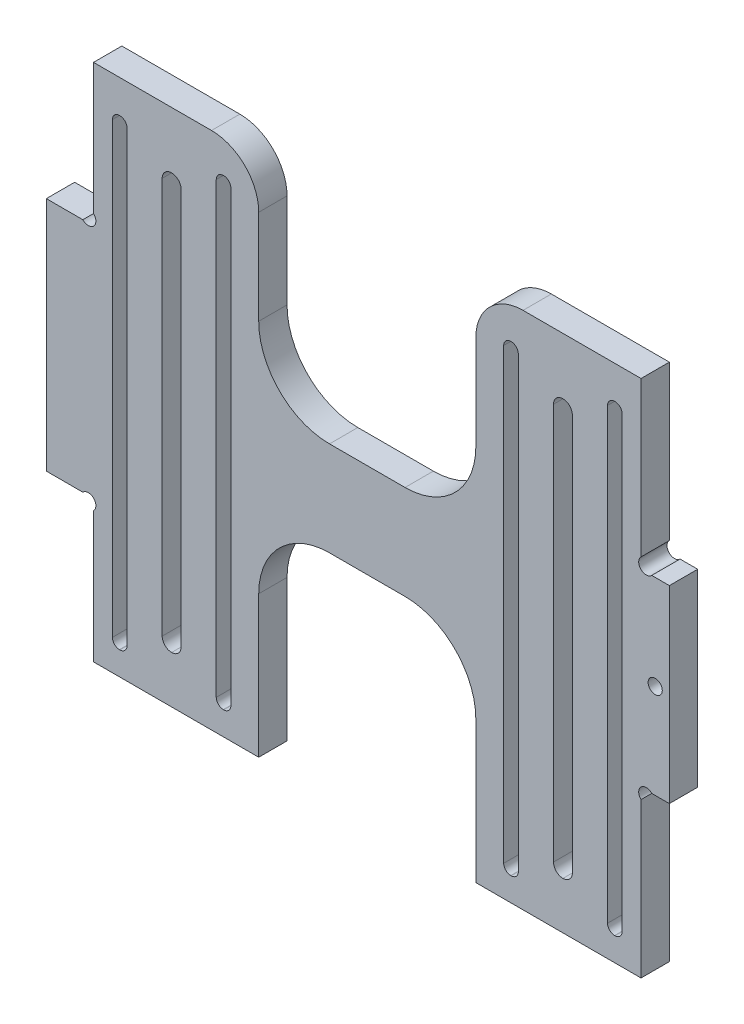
SolidWorks part; units mm, degrees
ref_plane "Face" through (0, 0, 0) normal (0, 0, 1) x (1, 0, 0)
ref_plane "Dessus" through (0, 0, 0) normal (0, 1, 0) x (1, 0, 0)
ref_plane "Droite" through (0, 0, 0) normal (1, 0, 0) x (0, 0, -1)
sketch "Esquisse1" plane through (0, 0, 0) normal (0, 0, 1) x (1, 0, 0)
  line L0 (-35.2138, -44.1969) -> (-35.2138, 65.8031)
  line L1 (-35.2138, 65.8031) -> (-0.2138, 65.8031)
  line L2 (80.7862, 65.8031) -> (80.7862, -44.1969)
  line L3 (80.7862, -44.1969) -> (45.7862, -44.1969)
  line L4 (45.7862, -44.1969) -> (45.7862, 0.8031)
  line L5 (45.7862, 0.8031) -> (-0.2138, 0.8031)
  line L6 (-0.2138, 0.8031) -> (-0.2138, -44.1969)
  line L7 (-0.2138, -44.1969) -> (-35.2138, -44.1969)
  line L8 (45.7862, 65.8031) -> (80.7862, 65.8031)
  line L10 (-0.2138, 65.8031) -> (-0.2138, 20.8031)
  line L11 (-0.2138, 20.8031) -> (45.7862, 20.8031)
  line L12 (45.7862, 65.8031) -> (45.7862, 20.8031)
  dimension "D1" = 116
  dimension "D2" = 110
  dimension "D3" = 35
  dimension "D4" = 35
  dimension "D5" = 110
  dimension "D6" = 45
  dimension "D7" = 45
extrude "Extrusion1" add sketch "Esquisse1" along normal blind 6
fillet "Congé1" radius 15 4 edges at (45.7862, 0.8031, 3) (-0.2138, 0.8031, 3) (45.7862, 20.8031, 3) (-0.2138, 20.8031, 3)
sketch "Esquisse2" plane through (0, 0, 6) normal (0, 0, 1) x (1, 0, 0)
  line L0 (45.7862, -44.1969) -> (80.7862, -44.1969) construction
  line L5 (73.6862, 58.8031) -> (76.7862, 58.8031)
  line L6 (73.6862, 58.8031) -> (73.6862, -39.1969)
  line L7 (73.6862, -39.1969) -> (76.7862, -39.1969)
  line L8 (76.7862, 58.8031) -> (76.7862, -39.1969)
  line L9 (51.6862, 58.8031) -> (54.7862, 58.8031)
  line L10 (51.6862, 58.8031) -> (51.6862, -39.1969)
  line L11 (51.6862, -39.1969) -> (54.7862, -39.1969)
  line L12 (54.7862, 58.8031) -> (54.7862, -39.1969)
  line L13 (-0.2138, 65.8031) -> (-35.2138, 65.8031) construction
  line L14 (80.7862, -44.1969) -> (80.7862, 65.8031) construction
  line L15 (-35.2138, -44.1969) -> (-0.2138, -44.1969) construction
  line L16 (-31.2138, -39.1969) -> (-28.1138, -39.1969)
  line L17 (-31.2138, -39.1969) -> (-31.2138, 58.8031)
  line L18 (-31.2138, 58.8031) -> (-28.1138, 58.8031)
  line L19 (-28.1138, -39.1969) -> (-28.1138, 58.8031)
  line L24 (-9.2138, -39.1969) -> (-6.1138, -39.1969)
  line L25 (-9.2138, -39.1969) -> (-9.2138, 58.8031)
  line L26 (-9.2138, 58.8031) -> (-6.1138, 58.8031)
  line L27 (-6.1138, -39.1969) -> (-6.1138, 58.8031)
  line L28 (-35.2138, 65.8031) -> (-35.2138, -44.1969) construction
  dimension "D1" = 3.1
  dimension "D3" = 3.1
  dimension "D4" = 5
  dimension "D6" = 5
  dimension "D7" = 7
  dimension "D9" = 7
  dimension "D10" = 4
  dimension "D12" = 26
  dimension "D13" = 3.1
  dimension "D14" = 3.1
  dimension "D15" = 5
  dimension "D16" = 5
  dimension "D17" = 7
  dimension "D18" = 7
  dimension "D19" = 4
  dimension "D20" = 26
extrude "Enlèv. mat.-Extru.1" cut sketch "Esquisse2" against normal blind 4.8
fillet "Congé2" radius 1.5 16 edges at (73.6862, 58.8031, 3.6) (51.6862, 58.8031, 3.6) (54.7862, 58.8031, 3.6) (76.7862, 58.8031, 3.6) (76.7862, -39.1969, 3.6) (54.7862, -39.1969, 3.6) (73.6862, -39.1969, 3.6) (51.6862, -39.1969, 3.6) (-9.2138, -39.1969, 3.6) (-31.2138, -39.1969, 3.6) (-28.1138, -39.1969, 3.6) (-6.1138, -39.1969, 3.6) (-9.2138, 58.8031, 3.6) (-31.2138, 58.8031, 3.6) (-6.1138, 58.8031, 3.6) (-28.1138, 58.8031, 3.6)
sketch "Esquisse3" plane through (0, 0, 6) normal (0, 0, 1) x (1, 0, 0)
  line L1 (62.2362, 53.8031) -> (66.2362, 53.8031)
  line L2 (62.2362, 53.8031) -> (62.2362, -34.1969)
  line L3 (62.2362, -34.1969) -> (66.2362, -34.1969)
  line L4 (66.2362, 53.8031) -> (66.2362, -34.1969)
  line L5 (-0.2138, 65.8031) -> (-35.2138, 65.8031) construction
  line L6 (45.7862, -44.1969) -> (80.7862, -44.1969) construction
  line L7 (-35.2138, -44.1969) -> (-0.2138, -44.1969) construction
  line L8 (-20.6638, 53.8031) -> (-16.6638, 53.8031)
  line L9 (-20.6638, 53.8031) -> (-20.6638, -34.1969)
  line L10 (-20.6638, -34.1969) -> (-16.6638, -34.1969)
  line L11 (-16.6638, 53.8031) -> (-16.6638, -34.1969)
  line L17 (76.7862, -37.6969) -> (76.7862, 57.3031) construction
  line L22 (-31.2138, 57.3031) -> (-31.2138, -37.6969) construction
  point P8 (63.2862, -44.1969)
  point P15 (-17.7138, -44.1969)
  dimension "D1" = 4
  dimension "D2" = 10.55
  dimension "D3" = 12
  dimension "D4" = 10
  dimension "D5" = 4
  dimension "D6" = 12
  dimension "D7" = 10
  dimension "D8" = 10.55
extrude "Enlèv. mat.-Extru.2" cut sketch "Esquisse3" against normal up to vertex
fillet "Congé3" radius 2 8 edges at (-20.6638, 53.8031, 3) (-16.6638, 53.8031, 3) (-16.6638, -34.1969, 3) (-20.6638, -34.1969, 3) (62.2362, -34.1969, 3) (66.2362, -34.1969, 3) (66.2362, 53.8031, 3) (62.2362, 53.8031, 3)
sketch "Esquisse5" plane through (80.7862, 0, 0) normal (1, 0, 0) x (0, 0, -1)
  line L0 (-6, -44.1969) -> (-6, 65.8031) construction
  line L1 (-6, 30.8031) -> (0, 30.8031)
  line L2 (-6, 30.8031) -> (-6, -9.1969)
  line L3 (-6, -9.1969) -> (0, -9.1969)
  line L4 (0, 30.8031) -> (0, -9.1969)
  line L5 (0, -44.1969) -> (0, 65.8031) construction
  line L6 (-6, 65.8031) -> (0, 65.8031) construction
  dimension "D1" = 40
  dimension "D2" = 35
extrude "Extrusion2" add sketch "Esquisse5" along normal blind 6
sketch "Esquisse6" plane through (-35.2138, 0, 0) normal (-1, 0, 0) x (0, 0, 1)
  line L0 (0, 65.8031) -> (0, -44.1969) construction
  line L1 (0, -14.1969) -> (6, -14.1969)
  line L2 (0, -14.1969) -> (0, 35.8031)
  line L3 (0, 35.8031) -> (6, 35.8031)
  line L4 (6, -14.1969) -> (6, 35.8031)
  line L5 (6, 65.8031) -> (6, -44.1969) construction
  line L6 (6, 65.8031) -> (0, 65.8031) construction
  dimension "D1" = 50
  dimension "D2" = 30
extrude "Extrusion3" add sketch "Esquisse6" along normal blind 10
sketch "Esquisse7" plane through (0, 0, 0) normal (0, 0, -1) x (-1, 0, 0)
  line L0 (-80.7862, 30.8031) -> (-80.7862, 65.8031) construction
  line L1 (-86.7862, 30.8031) -> (-80.7862, 30.8031) construction
  line L2 (-86.7862, -9.1969) -> (-80.7862, -9.1969) construction
  line L3 (-80.7862, -44.1969) -> (-80.7862, -9.1969) construction
  line L4 (45.2138, -14.1969) -> (35.2138, -14.1969) construction
  line L5 (35.2138, -14.1969) -> (35.2138, -44.1969) construction
  line L6 (45.2138, 35.8031) -> (35.2138, 35.8031) construction
  line L7 (35.2138, 65.8031) -> (35.2138, 35.8031) construction
  circle A0 centre (-81.8862, 31.9031) radius 1.6
  circle A1 centre (-81.8862, -10.2969) radius 1.6
  circle A2 centre (36.3138, -15.2969) radius 1.6
  circle A3 centre (36.3138, 36.9031) radius 1.6
  dimension "D1" = 1.1
  dimension "D3" = 1.1
  dimension "D5" = 1.1
  dimension "D7" = 1.1
  dimension "D2" = 1.1
  dimension "D4" = 1.1
  dimension "D6" = 1.1
  dimension "D8" = 1.1
extrude "Enlèv. mat.-Extru.3" cut sketch "Esquisse7" against normal up to vertex
sketch "Esquisse8" plane through (0, 0, 6) normal (0, 0, 1) x (1, 0, 0)
  line L0 (86.7862, 30.8031) -> (83.0481, 30.8031) construction
  line L1 (86.7862, 30.8031) -> (86.7862, -9.1969) construction
  circle A0 centre (83.7862, 10.8031) radius 1.5
  dimension "D1" = 20
  dimension "D2" = 3
extrude "Enlèv. mat.-Extru.4" cut sketch "Esquisse8" against normal blind 10
fillet "Congé4" radius 10 2 edges at (45.7862, 65.8031, 3) (-0.2138, 65.8031, 3)
